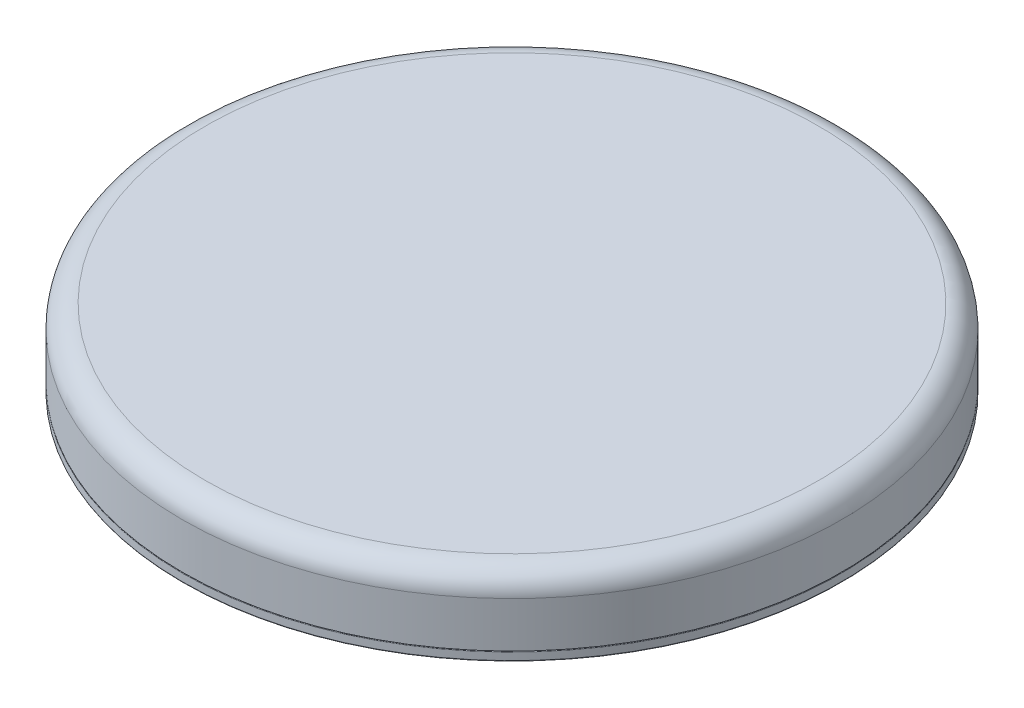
SolidWorks part; units mm, degrees
ref_plane "Alzado" through (0, 0, 0) normal (0, 0, 1) x (1, 0, 0)
ref_plane "Planta" through (0, 0, 0) normal (0, 1, 0) x (1, 0, 0)
ref_plane "Vista lateral" through (0, 0, 0) normal (1, 0, 0) x (0, 0, -1)
sketch "Croquis1" plane through (0, 0, 0) normal (0, 1, 0) x (1, 0, 0)
  circle A0 centre (0, 0) radius 72.5
extrude "Saliente-Extruir1" add sketch "Croquis1" along normal blind 2
fillet "Redondeo1" radius 0.2 2 edges at (0, 0, 72.5) (0, 2, 72.5)
sketch "Croquis2" plane through (0, 0, 0) normal (0, -1, 0) x (1, 0, 0)
  circle A0 centre (0, 0) radius 7.5
  circle A1 centre (0, 0) radius 11
  dimension "D1" = 22
  dimension "D2" = 15
extrude "Saliente-Extruir2" add sketch "Croquis2" along normal blind 4 contours A1 A0
fillet "Redondeo2" radius 0.2 3 edges at (0, 0, 11) (0, -4, -7.5) (0, -4, -11)
sketch "Croquis3" plane through (0, 2, 0) normal (0, 1, 0) x (1, 0, 0)
  circle A0 centre (0, 0) radius 72.5
extrude "Saliente-Extruir3" add sketch "Croquis3" along normal blind 15 separate body
fillet "Redondeo3" radius 5 1 edges at (0, 17, 72.5)
